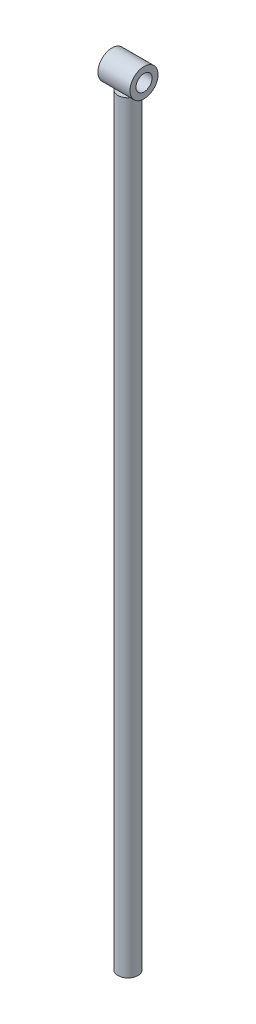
SolidWorks part; units mm, degrees
ref_plane "Plan de face" through (0, 0, 0) normal (0, 0, 1) x (1, 0, 0)
ref_plane "Plan de dessus" through (0, 0, 0) normal (0, 1, 0) x (1, 0, 0)
ref_plane "Plan de droite" through (0, 0, 0) normal (1, 0, 0) x (0, 0, -1)
sketch "Esquisse1" plane through (0, 0, 0) normal (0, 1, 0) x (1, 0, 0)
  circle A0 centre (0, 0) radius 12.5
  dimension "D1" = 25
extrude "Extrusion1" add sketch "Esquisse1" along normal blind 950
sketch "Esquisse2" plane through (0, 0, 0) normal (1, 0, 0) x (0, 0, -1)
  line L0 (12.5, 950) -> (-12.5, 950) construction
  circle A0 centre (0, 967.5) radius 17.5
  circle A1 centre (0, 967.5) radius 10
  dimension "D1" = 35
  dimension "D2" = 20
extrude "Extrusion2" add sketch "Esquisse2" along normal mid plane 40
